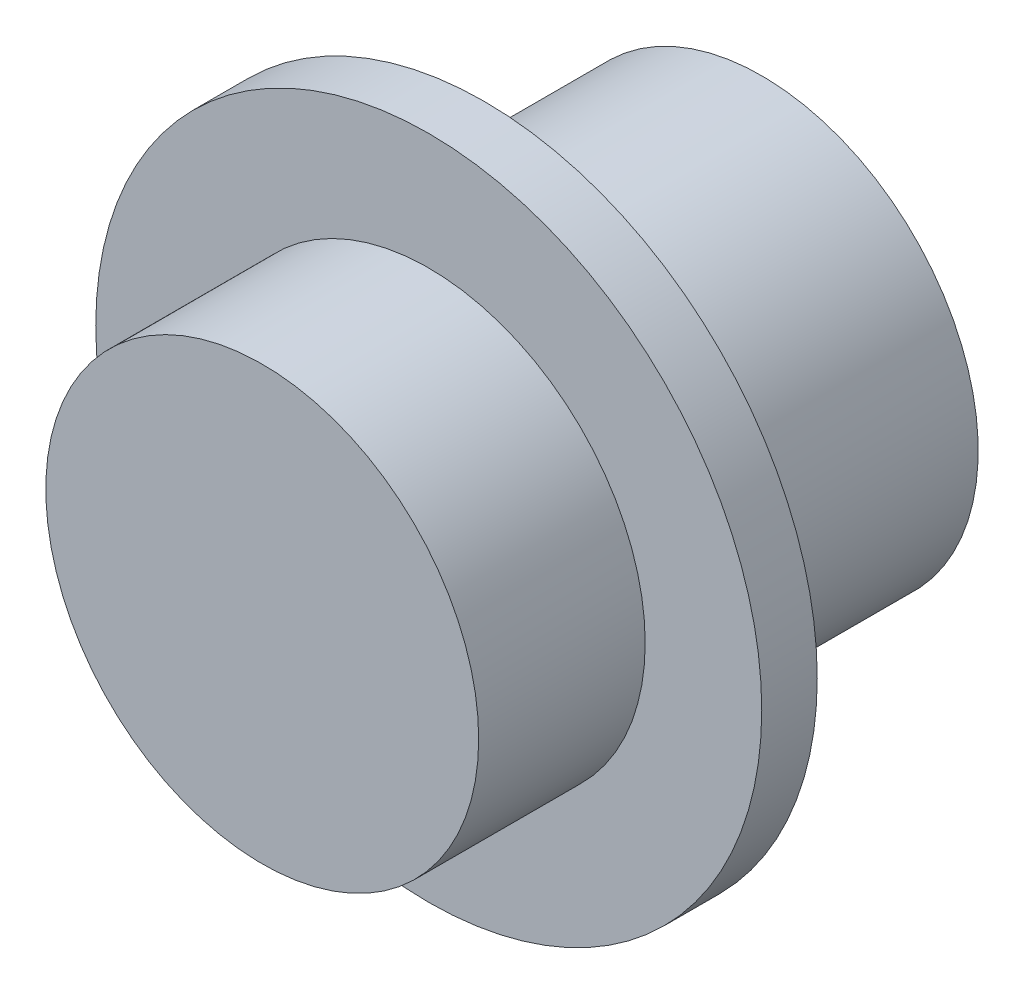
SolidWorks part; units mm, degrees
ref_plane "Front Plane" through (0, 0, 0) normal (0, 0, 1) x (1, 0, 0)
ref_plane "Top Plane" through (0, 0, 0) normal (0, 1, 0) x (1, 0, 0)
ref_plane "Right Plane" through (0, 0, 0) normal (1, 0, 0) x (0, 0, -1)
sketch "Sketch1" plane through (0, 0, 0) normal (0, 0, 1) x (1, 0, 0)
  circle A0 centre (0, 0) radius 3
extrude "Boss-Extrude1" add sketch "Sketch1" along normal blind 4.5
sketch "Sketch2" plane through (0, 0, 4.5) normal (0, 0, 1) x (1, 0, 0)
  circle A0 centre (0, 0) radius 1.95
  circle A1 centre (0, 0) radius 3
extrude "Cut-Extrude1" cut sketch "Sketch2" against normal blind 1.5
sketch "Sketch3" plane through (0, 0, 0) normal (0, 0, -1) x (-1, 0, 0)
  circle A0 centre (0, 0) radius 1.95
  circle A1 centre (0, 0) radius 3
extrude "Cut-Extrude2" cut sketch "Sketch3" against normal blind 2.5
hole_wizard "Tap Drill for #2-56 Tap1" positions "Sketch5" profile "Sketch4" hole size "#2-56" standard "Ansi Inch"
sketch "Sketch5" plane through (0, 0, 0) normal (0, 0, -1) x (-1, 0, 0)
  point P1 (0, 0)
sketch "Sketch4" plane through (0, 0, 0) normal (1, 0, 0) x (0, 1, 0)
  line L0 (0, 0) -> (0, 4.0342)
  line L1 (0, 4.0342) -> (0.889, 3.5)
  line L2 (0.889, 3.5) -> (0.889, 0)
  line L5 (0.889, 0) -> (0, 0)
  line L10 (0, 4.0342) -> (-0.889, 3.5) construction
  line L11 (0, -6.35) -> (0, 107.95) construction
  dimension "Hole Dia." = 1.778
  dimension "Hole Depth" = 3.5
  dimension "Drill Angle" = 118
